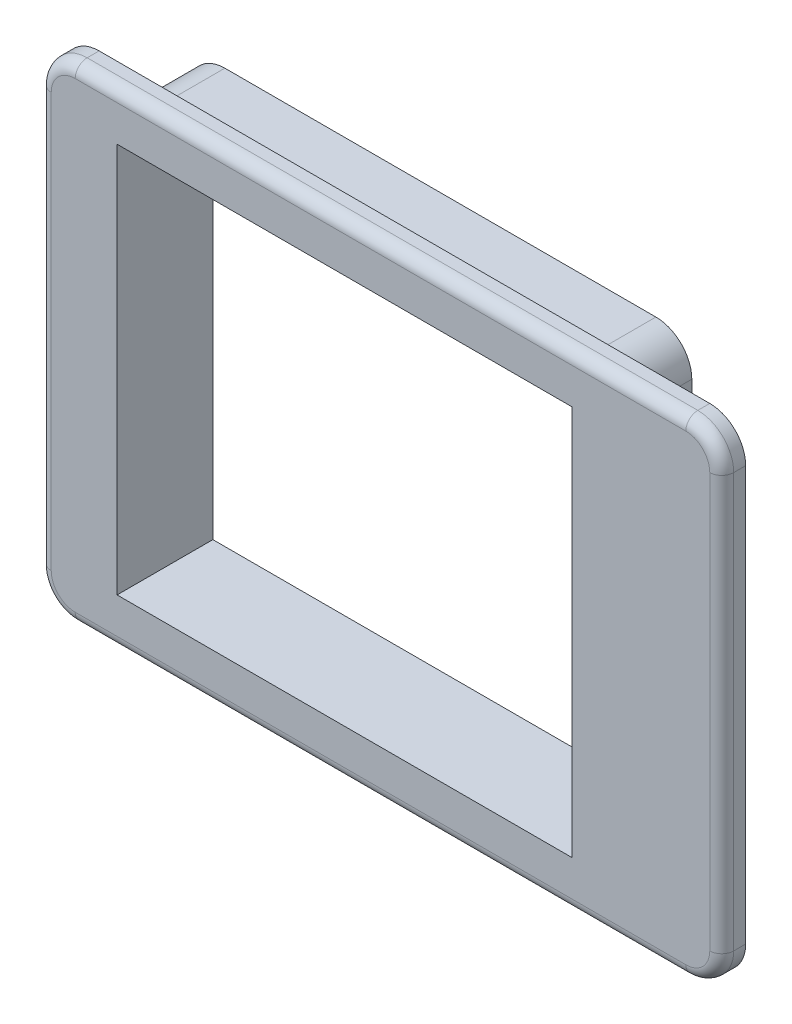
SolidWorks part; units mm, degrees
ref_plane "Front Plane" through (0, 0, 0) normal (0, 0, 1) x (1, 0, 0)
ref_plane "Top Plane" through (0, 0, 0) normal (0, 1, 0) x (1, 0, 0)
ref_plane "Right Plane" through (0, 0, 0) normal (1, 0, 0) x (0, 0, -1)
sketch "Sketch1" plane through (0, 0, 0) normal (0, 0, 1) x (1, 0, 0)
  line L1 (0, 0) -> (38, 0)
  line L2 (0, 0) -> (0, 32.6)
  line L3 (0, 32.6) -> (38, 32.6)
  line L4 (38, 0) -> (38, 32.6)
  line L5 (1, 34.6) -> (37, 34.6)
  line L6 (-2, 31.6) -> (-2, 1)
  line L7 (1, -2) -> (37, -2)
  line L8 (40, 31.6) -> (40, 1)
  arc A0 (-2, 1) -> (1, -2) centre (1, 1) ccw
  arc A1 (37, -2) -> (40, 1) centre (37, 1) ccw
  arc A2 (37, 34.6) -> (40, 31.6) centre (37, 31.6) cw
  arc A3 (1, 34.6) -> (-2, 31.6) centre (1, 31.6) ccw
  dimension "D7" = 3
  dimension "D1" = 38
  dimension "D2" = 32.6
  dimension "D3" = 2
  dimension "D4" = 2
  dimension "D5" = 2
  dimension "D6" = 2
extrude "Boss-Extrude1" add sketch "Sketch1" along normal blind 6
sketch "Sketch2" plane through (0, 0, 6) normal (0, 0, 1) x (1, 0, 0)
  line L0 (37, 34.6) -> (1, 34.6) construction
  line L1 (-3.5, 36.6) -> (47.5, 36.6)
  line L2 (-6.5, 33.6) -> (-6.5, -1)
  line L3 (-3.5, -4) -> (47.5, -4)
  line L4 (50.5, 33.6) -> (50.5, -1)
  line L5 (1, -2) -> (37, -2) construction
  line L6 (40, 1) -> (40, 31.6) construction
  line L7 (-2, 31.6) -> (-2, 1) construction
  line L9 (0, 32.6) -> (38, 32.6)
  line L10 (0, 32.6) -> (0, 0)
  line L11 (0, 0) -> (38, 0)
  line L12 (38, 32.6) -> (38, 0)
  arc A0 (-6.5, -1) -> (-3.5, -4) centre (-3.5, -1) ccw
  arc A1 (47.5, -4) -> (50.5, -1) centre (47.5, -1) ccw
  arc A2 (47.5, 36.6) -> (50.5, 33.6) centre (47.5, 33.6) cw
  arc A3 (-3.5, 36.6) -> (-6.5, 33.6) centre (-3.5, 33.6) ccw
  dimension "D5" = 3
  dimension "D1" = 2
  dimension "D2" = 2
  dimension "D3" = 10.5
  dimension "D4" = 4.5
extrude "Boss-Extrude2" add sketch "Sketch2" along normal blind 2
fillet "Fillet1" radius 1 8 edges at (-5.6213, 35.7213, 8) (-6.5, 16.3, 8) (-5.6213, -3.1213, 8) (22, -4, 8) (49.6213, -3.1213, 8) (50.5, 16.3, 8) (49.6213, 35.7213, 8) (22, 36.6, 8)
